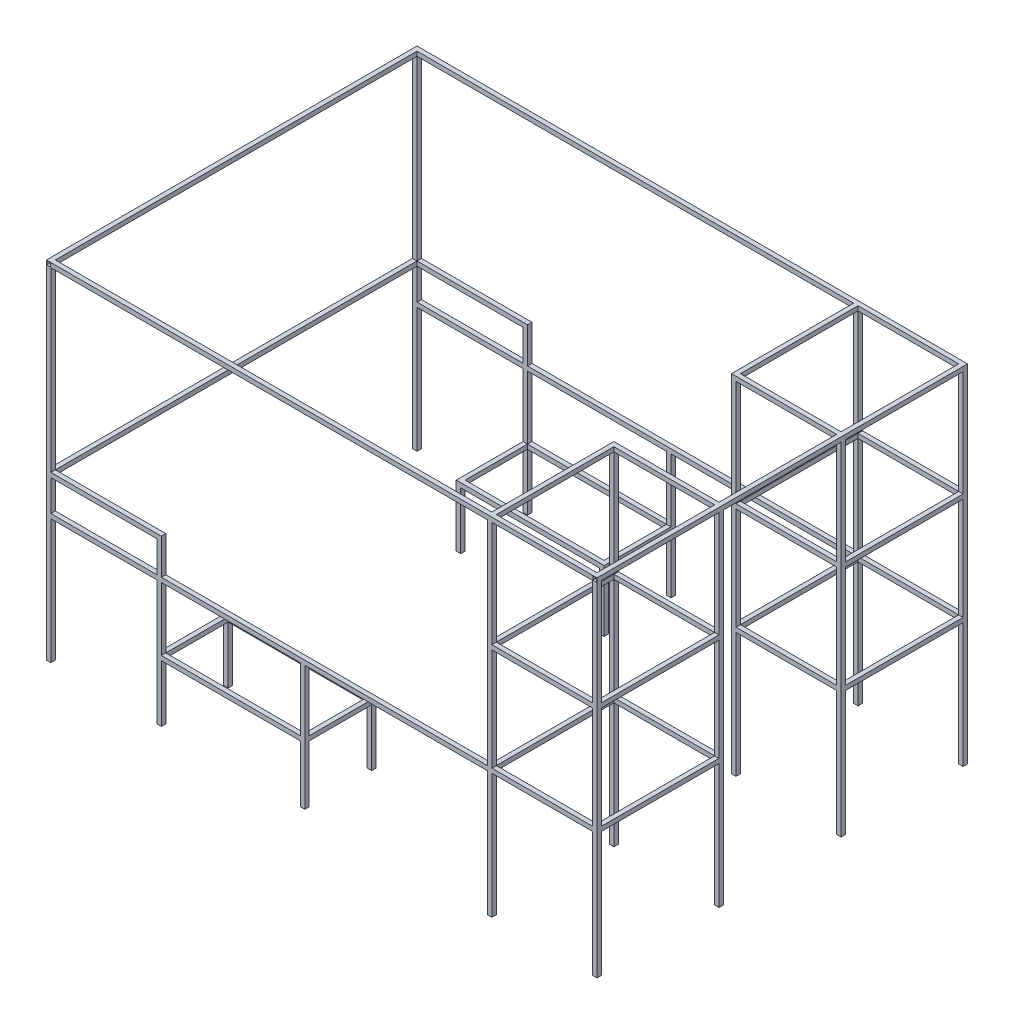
SolidWorks part; units mm, degrees
ref_plane "Plan de face" through (0, 0, 0) normal (0, 0, 1) x (1, 0, 0)
ref_plane "Plan de dessus" through (0, 0, 0) normal (0, 1, 0) x (1, 0, 0)
ref_plane "Plan de droite" through (0, 0, 0) normal (1, 0, 0) x (0, 0, -1)
sketch "Esquisse1" plane through (0, 0, 0) normal (0, 0, 1) x (1, 0, 0)
  line L0 (0, 0) -> (0, 1945)
  line L1 (0, 1945) -> (3090, 1945)
  line L2 (3090, 1945) -> (3090, 0)
  line L3 (3090, 0) -> (3065, 0)
  line L4 (3065, 0) -> (3065, 1920)
  line L5 (3065, 1920) -> (25, 1920)
  line L6 (25, 1920) -> (25, 0)
  line L7 (25, 0) -> (0, 0)
  dimension "D1" = 3090
  dimension "D2" = 25
  dimension "D3" = 1945
  dimension "D4" = 1920
  dimension "D5" = 25
extrude "Boss.-Extru.1" add sketch "Esquisse1" along normal blind 25
sketch "Esquisse2" plane through (0, 0, 0) normal (0, 0, -1) x (-1, 0, 0)
  line L1 (-3090, 1945) -> (-3065, 1945)
  line L2 (-3090, 1945) -> (-3090, 1920)
  line L3 (-3090, 1920) -> (-3065, 1920)
  line L4 (-3065, 1945) -> (-3065, 1920)
  line L5 (-25, 1920) -> (0, 1920)
  line L6 (-25, 1920) -> (-25, 1945)
  line L7 (-25, 1945) -> (0, 1945)
  line L8 (0, 1920) -> (0, 1945)
extrude "Boss.-Extru.2" add sketch "Esquisse2" along normal blind 2030
sketch "Esquisse3" plane through (0, 0, -2030) normal (0, 0, -1) x (-1, 0, 0)
  line L0 (-3090, 0) -> (-3090, 1945)
  line L1 (-3090, 1945) -> (0, 1945)
  line L2 (0, 1945) -> (0, 0)
  line L3 (0, 0) -> (-25, 0)
  line L4 (-25, 0) -> (-25, 1920)
  line L5 (-25, 1920) -> (-3065, 1920)
  line L6 (-3065, 1920) -> (-3065, 0)
  line L7 (-3065, 0) -> (-3090, 0)
extrude "Boss.-Extru.3" add sketch "Esquisse3" along normal blind 25
sketch "Esquisse4" plane through (0, 0, -2055) normal (0, 0, -1) x (-1, 0, 0)
  line L0 (0, 1945) -> (-3090, 1945) construction
  line L1 (-3088, 1943) -> (-3067, 1943)
  line L2 (-3088, 1943) -> (-3088, 1922)
  line L3 (-3088, 1922) -> (-3067, 1922)
  line L4 (-3067, 1943) -> (-3067, 1922)
  line L5 (-23, 1943) -> (-2, 1943)
  line L6 (-23, 1943) -> (-23, 1922)
  line L7 (-23, 1922) -> (-2, 1922)
  line L8 (-2, 1943) -> (-2, 1922)
  line L9 (-3090, 1945) -> (-3090, 0) construction
  dimension "D1" = 21
  dimension "D2" = 21
  dimension "D3" = 2
  dimension "D4" = 2
  dimension "D5" = 21
  dimension "D6" = 21
  dimension "D7" = 2
  dimension "D8" = 2
extrude "Enlèv. mat.-Extru.1" cut sketch "Esquisse4" against normal through all
sketch "Esquisse5" plane through (0, 0, 0) normal (0, 0, 1) x (1, 0, 0)
  line L0 (620, 900) -> (620, 725)
  line L1 (620, 900) -> (25, 900)
  line L2 (25, 0) -> (25, 1920) construction
  line L3 (25, 900) -> (25, 925)
  line L4 (25, 925) -> (645, 925)
  line L5 (645, 925) -> (645, 725)
  line L6 (645, 725) -> (2475, 725)
  line L7 (2475, 725) -> (2475, 1920)
  line L8 (25, 1920) -> (3065, 1920) construction
  line L9 (2475, 1920) -> (2500, 1920)
  line L10 (2500, 1920) -> (2500, 0)
  line L11 (2500, 0) -> (2475, 0)
  line L12 (2475, 0) -> (2475, 700)
  line L13 (2475, 700) -> (1450, 700)
  line L14 (1450, 700) -> (1450, 0)
  line L15 (1450, 0) -> (1425, 0)
  line L16 (645, 700) -> (645, 345)
  line L17 (1425, 700) -> (645, 700)
  line L18 (645, 320) -> (645, 0)
  line L19 (645, 0) -> (620, 0)
  line L20 (0, 1945) -> (0, 0) construction
  line L21 (3090, 0) -> (3090, 1945) construction
  line L22 (620, 725) -> (25, 725)
  line L23 (25, 725) -> (25, 700)
  line L24 (25, 700) -> (620, 700)
  line L25 (645, 345) -> (1425, 345)
  line L26 (1425, 700) -> (1425, 345)
  line L27 (1425, 320) -> (645, 320)
  line L28 (620, 700) -> (620, 0)
  line L29 (1425, 320) -> (1425, 0)
  dimension "D1" = 645
  dimension "D2" = 615
  dimension "D3" = 25
  dimension "D4" = 25
  dimension "D5" = 25
  dimension "D6" = 25
  dimension "D7" = 25
  dimension "D8" = 780
  dimension "D9" = 700
  dimension "D10" = 900
  dimension "D11" = 320
  dimension "D12" = 25
extrude "Boss.-Extru.4" add sketch "Esquisse5" along normal blind 25 separate body
sketch "Esquisse6" plane through (0, 0, 0) normal (0, 0, 1) x (1, 0, 0)
  line L0 (25, 925) -> (645, 925)
  line L1 (645, 925) -> (645, 725)
  line L2 (645, 725) -> (645, 925) construction
  line L3 (645, 725) -> (2475, 725)
  line L4 (2475, 725) -> (2475, 1920)
  line L5 (2475, 1920) -> (2500, 1920)
  line L6 (2500, 1920) -> (2500, 0)
  line L7 (2500, 0) -> (2475, 0)
  line L8 (2475, 0) -> (2475, 700)
  line L9 (2475, 700) -> (1450, 700)
  line L10 (1450, 700) -> (1450, 0)
  line L11 (1450, 0) -> (1425, 0)
  line L12 (1425, 0) -> (1425, 320)
  line L13 (1425, 320) -> (645, 320)
  line L14 (645, 320) -> (645, 0)
  line L15 (645, 0) -> (620, 0)
  line L16 (620, 0) -> (620, 700)
  line L17 (620, 700) -> (25, 700)
  line L18 (25, 700) -> (25, 725)
  line L19 (25, 725) -> (620, 725)
  line L20 (620, 725) -> (620, 900)
  line L21 (620, 900) -> (25, 900)
  line L22 (25, 900) -> (25, 925)
  line L23 (645, 700) -> (1425, 700)
  line L24 (1425, 700) -> (1425, 345)
  line L25 (1425, 345) -> (645, 345)
  line L26 (645, 345) -> (645, 700)
extrude "Boss.-Extru.5" add sketch "Esquisse6" along normal blind 25 from offset 2055
sketch "Esquisse7" plane through (0, 0, 0) normal (0, 0, 1) x (1, 0, 0)
  line L0 (2500, 1920) -> (2500, 0)
  line L1 (2500, 0) -> (2475, 0)
  line L2 (2475, 0) -> (2475, 1920)
  line L3 (2475, 1920) -> (2500, 1920)
extrude "Boss.-Extru.6" add sketch "Esquisse7" against normal blind 25 from offset 660 separate body
sketch "Esquisse8" plane through (0, 0, 0) normal (0, 0, 1) x (1, 0, 0)
  line L0 (2475, 1920) -> (2500, 1920)
  line L1 (2500, 1920) -> (2500, 0)
  line L2 (2500, 0) -> (2475, 0)
  line L3 (2475, 0) -> (2475, 1920)
extrude "Boss.-Extru.7" add sketch "Esquisse8" against normal blind 25 from offset 1345 separate body
sketch "Esquisse9" plane through (0, 1945, 0) normal (0, 1, 0) x (1, 0, 0)
  line L0 (2475, 1345) -> (2475, 2030)
  line L1 (2475, 2030) -> (2500, 2030)
  line L2 (25, 2030) -> (3065, 2030) construction
  line L3 (2500, 2030) -> (2500, 1370)
  line L4 (2500, 1370) -> (3065, 1370)
  line L5 (3065, 2030) -> (3065, 0) construction
  line L6 (3065, 1370) -> (3065, 1345)
  line L7 (3065, 1345) -> (2475, 1345)
  line L8 (2475, 685) -> (3065, 685)
  line L9 (3065, 685) -> (3065, 660)
  line L10 (3065, 660) -> (2500, 660)
  line L11 (2500, 660) -> (2500, 0)
  line L12 (3065, 0) -> (25, 0) construction
  line L13 (2500, 0) -> (2475, 0)
  line L14 (2475, 0) -> (2475, 685)
extrude "Boss.-Extru.8" add sketch "Esquisse9" against normal blind 25
sketch "Esquisse10" plane through (0, 0, 0) normal (-1, 0, 0) x (0, 0, 1)
  line L0 (-2030, 925) -> (0, 925)
  line L1 (-2030, 0) -> (-2030, 1920) construction
  line L2 (0, 1920) -> (0, 0) construction
  line L3 (0, 925) -> (0, 900)
  line L4 (0, 900) -> (-2030, 900)
  line L5 (-2030, 900) -> (-2030, 925)
  dimension "D1" = 25
  dimension "D2" = 900
extrude "Boss.-Extru.9" add sketch "Esquisse10" against normal blind 25
sketch "Esquisse11" plane through (0, 0, 25) normal (0, 0, 1) x (1, 0, 0)
  line L0 (645, 0) -> (645, 320)
  line L1 (645, 320) -> (1425, 320)
  line L2 (1425, 320) -> (1425, 0)
  line L3 (1425, 0) -> (1450, 0)
  line L4 (1450, 0) -> (1450, 345)
  line L6 (1450, 345) -> (620, 345)
  line L8 (620, 345) -> (620, 0)
  line L9 (620, 0) -> (645, 0)
  dimension "D1" = 25
extrude "Boss.-Extru.10" add sketch "Esquisse11" against normal blind 25 from offset 375 separate body
sketch "Esquisse12" plane through (0, 0, -2055) normal (0, 0, -1) x (-1, 0, 0)
  line L0 (-1425, 0) -> (-1425, 320)
  line L1 (-1425, 320) -> (-645, 320)
  line L2 (-645, 320) -> (-645, 0)
  line L3 (-645, 0) -> (-620, 0)
  line L4 (-620, 0) -> (-620, 345)
  line L5 (-620, 700) -> (-620, 0) construction
  line L6 (-620, 345) -> (-1450, 345)
  line L7 (-1450, 0) -> (-1450, 700) construction
  line L8 (-1450, 345) -> (-1450, 0)
  line L9 (-1450, 0) -> (-1425, 0)
  line L10 (-645, 320) -> (-1425, 320) construction
  line L11 (-645, 345) -> (-1425, 345) construction
extrude "Boss.-Extru.11" add sketch "Esquisse12" against normal blind 25 from offset 375 separate body
sketch "Esquisse13" plane through (0, 345, 0) normal (0, 1, 0) x (1, 0, 0)
  line L0 (1450, 1680) -> (1450, 2040)
  line L1 (1450, 2040) -> (1425, 2040)
  line L3 (1425, 2040) -> (1425, 1680)
  line L4 (620, 1680) -> (1450, 1680) construction
  line L5 (1425, 1680) -> (1450, 1680)
  line L6 (620, 1680) -> (645, 1680)
  line L7 (645, 1680) -> (645, 2040)
  line L9 (645, 2040) -> (620, 2040)
  line L10 (620, 2040) -> (620, 1680)
  line L12 (620, 350) -> (620, -10)
  line L14 (620, -10) -> (645, -10)
  line L15 (645, -10) -> (645, 350)
  line L16 (645, 350) -> (620, 350)
  line L17 (1450, 350) -> (1450, -10)
  line L18 (1450, -10) -> (1425, -10)
  line L19 (1425, -10) -> (1425, 350)
  line L20 (1450, 350) -> (620, 350) construction
  line L21 (1425, 350) -> (1450, 350)
  dimension "D1" = 25
  dimension "D2" = 25
  dimension "D3" = 360
  dimension "D4" = 25
  dimension "D5" = 360
  dimension "D6" = 360
extrude "Boss.-Extru.12" add sketch "Esquisse13" against normal blind 25
sketch "Esquisse14" plane through (0, 0, 0) normal (0, 1, 0) x (1, 0, 0)
  line L1 (2475, 1345) -> (3090, 1345)
  line L2 (2475, 1345) -> (2475, 2055)
  line L3 (2475, 2055) -> (3090, 2055)
  line L4 (3090, 1345) -> (3090, 2055)
  line L5 (2475, 685) -> (3090, 685)
  line L6 (2475, 685) -> (2475, -25)
  line L7 (2475, -25) -> (3090, -25)
  line L8 (3090, 685) -> (3090, -25)
  line L9 (2500, 1370) -> (3065, 1370)
  line L10 (2500, 1370) -> (2500, 2030)
  line L11 (2500, 2030) -> (3065, 2030)
  line L12 (3065, 1370) -> (3065, 2030)
  line L13 (2500, 660) -> (3065, 660)
  line L14 (2500, 660) -> (2500, 0)
  line L15 (2500, 0) -> (3065, 0)
  line L16 (3065, 660) -> (3065, 0)
  dimension "D1" = 25
  dimension "D2" = 25
  dimension "D3" = 25
extrude "Boss.-Extru.13" add sketch "Esquisse14" along normal blind 25 from offset 700
sketch "Esquisse15" plane through (0, 0, 0) normal (0, 1, 0) x (1, 0, 0)
  line L1 (2475, 1345) -> (3090, 1345)
  line L2 (2475, 1345) -> (2475, 2055)
  line L3 (2475, 2055) -> (3090, 2055)
  line L4 (3090, 1345) -> (3090, 2055)
  line L5 (2500, 1370) -> (3065, 1370)
  line L6 (2500, 1370) -> (2500, 2030)
  line L7 (2500, 2030) -> (3065, 2030)
  line L8 (3065, 1370) -> (3065, 2030)
  line L9 (2475, 685) -> (3090, 685)
  line L10 (2475, 685) -> (2475, -25)
  line L11 (2475, -25) -> (3090, -25)
  line L12 (3090, 685) -> (3090, -25)
  line L13 (2500, 660) -> (3065, 660)
  line L14 (2500, 660) -> (2500, 0)
  line L15 (2500, 0) -> (3065, 0)
  line L16 (3065, 660) -> (3065, 0)
  dimension "D1" = 25
  dimension "D2" = 25
  dimension "D3" = 25
  dimension "D4" = 25
extrude "Boss.-Extru.14" add sketch "Esquisse15" along normal blind 25 from offset 1300
sketch "Esquisse16" plane through (3090, 0, 0) normal (1, 0, 0) x (0, 0, -1)
  line L0 (685, 0) -> (685, 1920)
  line L1 (685, 1920) -> (660, 1920)
  line L2 (660, 1920) -> (660, 0)
  line L3 (660, 0) -> (685, 0)
  line L4 (1345, 0) -> (1370, 0)
  line L5 (1370, 0) -> (1370, 1920)
  line L6 (1370, 1920) -> (1345, 1920)
  line L7 (1345, 1920) -> (1345, 0)
  line L8 (2030, 1920) -> (0, 1920) construction
  line L9 (685, 1325) -> (685, 1920) construction
  line L10 (1345, 1325) -> (1345, 1920) construction
extrude "Boss.-Extru.15" add sketch "Esquisse16" against normal blind 25
